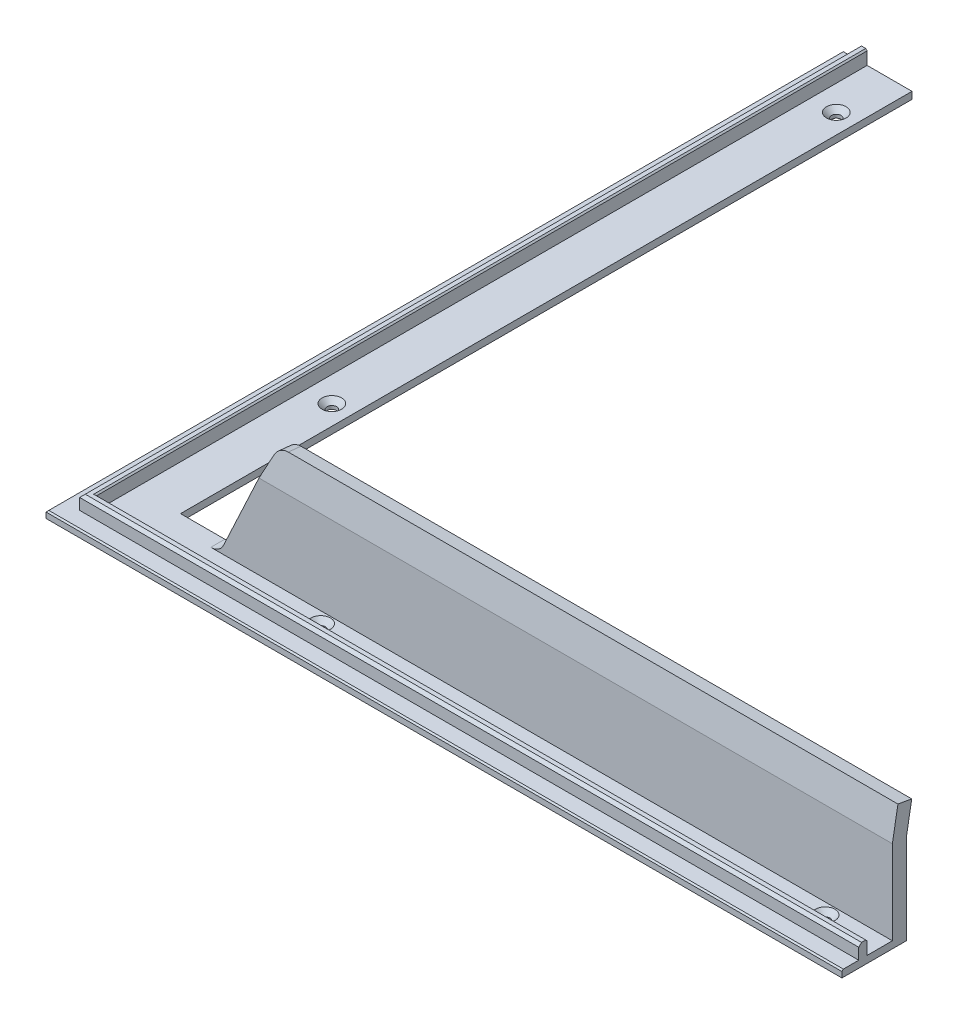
SolidWorks part; units mm, degrees
ref_plane "Ebene vorne" through (0, 0, 0) normal (0, 0, 1) x (1, 0, 0)
ref_plane "Ebene oben" through (0, 0, 0) normal (0, 1, 0) x (1, 0, 0)
ref_plane "Ebene rechts" through (0, 0, 0) normal (1, 0, 0) x (0, 0, -1)
sketch "Skizze1" plane through (0, 0, 0) normal (0, 1, 0) x (1, 0, 0)
  line L0 (0, 0) -> (0, 261)
  line L1 (0, 261) -> (-25, 261)
  line L2 (-25, 261) -> (-25, -23)
  line L3 (-25, -23) -> (259, -23)
  line L4 (259, -23) -> (259, 0)
  line L5 (259, 0) -> (0, 0)
  dimension "D1" = 23
  dimension "D2" = 284
  dimension "D3" = 284
  dimension "D4" = 25
extrude "Aufsatz-Linear austragen1" add sketch "Skizze1" along normal blind 3
sketch "Skizze2" plane through (0, 3, 0) normal (0, 1, 0) x (1, 0, 0)
  line L0 (-19, 261) -> (-19, -17)
  line L1 (0, 261) -> (-25, 261) construction
  line L2 (-19, -17) -> (259, -17)
  line L3 (259, -23) -> (259, 0) construction
  line L4 (259, -17) -> (259, -14)
  line L5 (259, -14) -> (-16, -14)
  line L6 (-16, -14) -> (-16, 261)
  line L7 (-16, 261) -> (-19, 261)
  line L8 (-25, -23) -> (259, -23) construction
  line L9 (-25, 261) -> (-25, -23) construction
  dimension "D1" = 6
  dimension "D2" = 3
  dimension "D3" = 6
extrude "Aufsatz-Linear austragen2" add sketch "Skizze2" along normal blind 5
chamfer "Fase1" distance 0.5 angle 45 10 edges at (117, 3, 23) (-25, 3, -119) (0, 0, -130.5) (-12.5, 0, -261) (-25, 0, -119) (117, 0, 23) (259, 0, 11.5) (129.5, 0, 0) (-16, 8, -123.5) (121.5, 8, 14)
chamfer "Fase2" distance 1 angle 45 2 edges at (-19, 8, -122) (120, 8, 17)
hole_wizard "Formsenkung für M3 Senkschraube mit Innensechskant1" positions "Skizze3" profile "Skizze4" countersink size "M3" standard "DIN"
sketch "Skizze3" plane through (0, 3, 0) normal (0, 1, 0) x (1, 0, 0)
  line L1 (259, -23) -> (-25, -23) construction
  line L2 (-25, -23) -> (-25, 261) construction
  line L5 (259, -14) -> (259, 0) construction
  line L6 (0, 261) -> (-16, 261) construction
  point P0 (239, -9)
  point P2 (59, -9)
  point P4 (-7, 61)
  point P6 (-7, 241)
  dimension "D1" = 14
  dimension "D2" = 18
  dimension "D3" = 20
  dimension "D4" = 180
  dimension "D5" = 180
  dimension "D6" = 20
sketch "Skizze4" plane through (239, 3, 9) normal (1, 0, 0) x (0, 0, 1)
  line L0 (0, 0) -> (0, 3)
  line L1 (0, 3) -> (1.7, 3)
  line L2 (1.7, 3) -> (1.7, 1.8)
  line L3 (1.7, 1.8) -> (3.5, 0)
  line L5 (3.5, 0) -> (0, 0)
  line L6 (-1.7, 1.8) -> (-3.5, 0) construction
  line L11 (0, -6.35) -> (0, 107.95) construction
  dimension "Bohrerdurchmesser" = 3.4
  dimension "Bohrungstiefe" = 3
  dimension "Senkdurchmesser (Oben)" = 7
  dimension "Senkwinkel (Oben)" = 90
sketch "Skizze5" plane through (259, 0, 0) normal (1, 0, 0) x (0, 0, -1)
  line L0 (0, 3) -> (0, 32.5626)
  line L1 (0, 32.5626) -> (1.9101, 43.3954)
  line L2 (1.9101, 43.3954) -> (-3.0139, 44.2637)
  line L3 (-3.0139, 44.2637) -> (-5, 33)
  line L4 (-5, 33) -> (-5, 3)
  line L5 (-14, 3) -> (0, 3) construction
  line L6 (-5, 3) -> (0, 3)
  dimension "D1" = 30
  dimension "D2" = 5
  dimension "D3" = 5
  dimension "D4" = 11
  dimension "D5" = 170
extrude "Aufsatz-Linear austragen3" add sketch "Skizze5" against normal blind 240
sketch "Skizze6" plane through (0, 0, 5) normal (0, 0, 1) x (1, 0, 0)
  line L0 (19, 3) -> (38.2416, 44.2637)
  line L1 (38.2416, 44.2637) -> (19, 44.2637)
  line L2 (19, 44.2637) -> (19, 3)
  line L3 (19, 44.2637) -> (259, 44.2637) construction
  line L4 (19, 33) -> (19, 3) construction
  dimension "D1" = 25
extrude "Schnitt-Linear austragen1" cut sketch "Skizze6" against normal through all
fillet "Verrundung1" radius 5 2 edges at (38.0391, 43.8296, 0.5519) (19, 3, 2.5)
